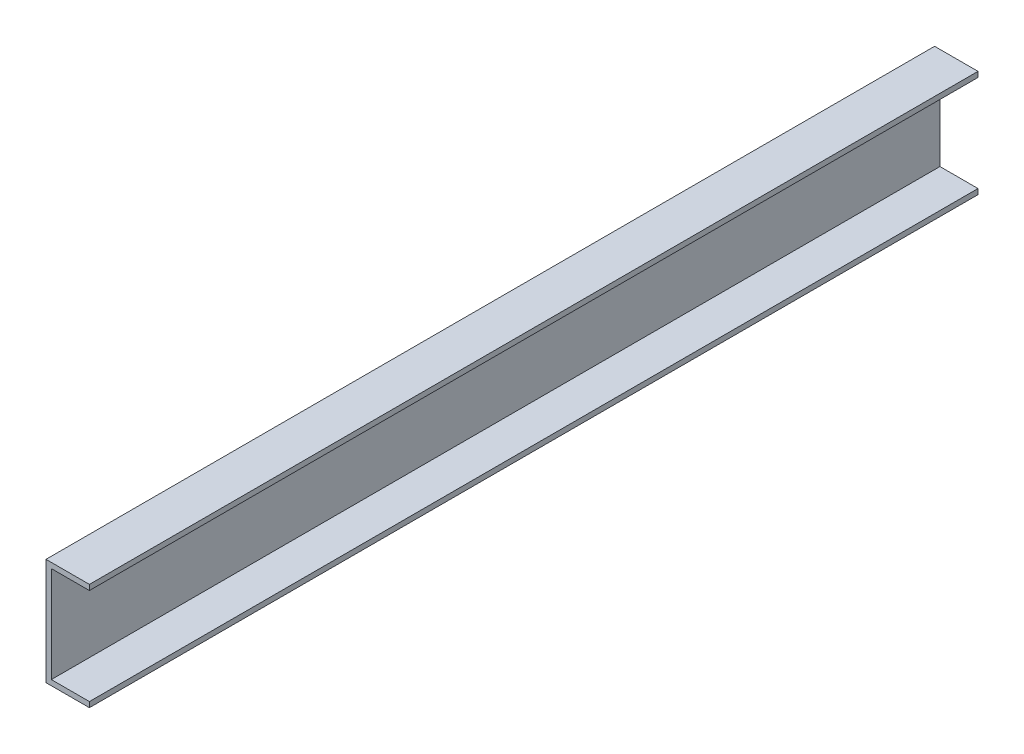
SolidWorks part; units mm, degrees
ref_plane "Front Plane" through (0, 0, 0) normal (0, 0, 1) x (1, 0, 0)
ref_plane "Top Plane" through (0, 0, 0) normal (0, 1, 0) x (1, 0, 0)
ref_plane "Right Plane" through (0, 0, 0) normal (1, 0, 0) x (0, 0, -1)
sketch "Sketch1" plane through (0, 0, 0) normal (0, 0, 1) x (1, 0, 0)
  line L0 (65, 0) -> (0, 0)
  line L1 (0, 0) -> (0, 160)
  line L2 (0, 160) -> (65, 160)
  line L3 (65, 160) -> (65, 152)
  line L4 (65, 152) -> (8, 152)
  line L5 (8, 152) -> (8, 8)
  line L6 (8, 8) -> (65, 8)
  line L7 (65, 8) -> (65, 0)
  dimension "D1" = 160
  dimension "D2" = 65
  dimension "D3" = 8
  dimension "D4" = 8
extrude "Boss-Extrude1" add sketch "Sketch1" along normal blind 1331
